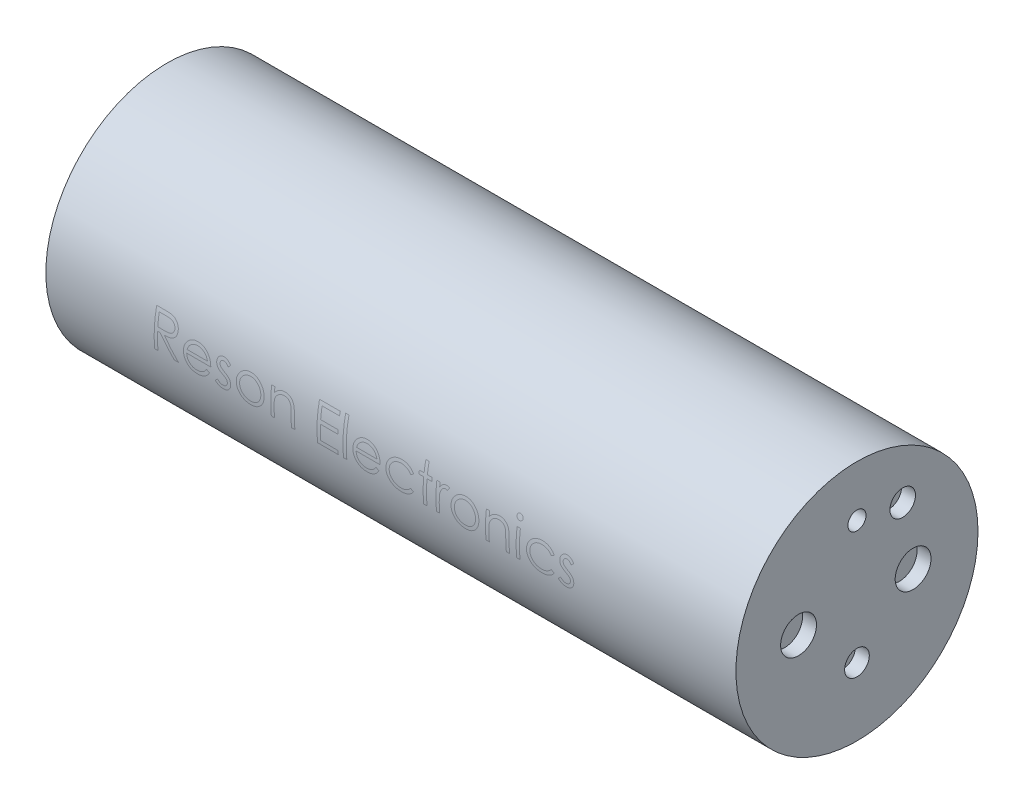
SolidWorks part; units mm, degrees
ref_plane "Front Plane" through (0, 0, 0) normal (0, 0, 1) x (1, 0, 0)
ref_plane "Top Plane" through (0, 0, 0) normal (0, 1, 0) x (1, 0, 0)
ref_plane "Right Plane" through (0, 0, 0) normal (1, 0, 0) x (0, 0, -1)
sketch "Sketch1" plane through (0, 0, 0) normal (1, 0, 0) x (0, 0, -1)
  circle A0 centre (0, 0) radius 87
  dimension "D1" = 174
extrude "Boss-Extrude1" add sketch "Sketch1" along normal blind 496
sketch "Sketch2" plane through (496, 0, 0) normal (1, 0, 0) x (0, 0, -1)
  circle A0 centre (0, 50.3305) radius 6.5096
  circle A1 centre (40.3467, 0) radius 12.8838
  circle A2 centre (-41.9935, 0) radius 12.8986
  circle A3 centre (0, -38.1853) radius 8.8683
  circle A4 centre (32.8723, 44.9918) radius 9.1853
sketch "Sketch3" plane through (0, 0, 0) normal (0, 0, 1) x (1, 0, 0)
  text T0 "Reson Electronics" font "Century Gothic" height in points 100
wrap "Wrap1" sketch "Sketch3" wrap type scribe source sketch "Sketch3"
extrude "Cut-Extrude1" cut sketch "Sketch2" against normal blind 10
